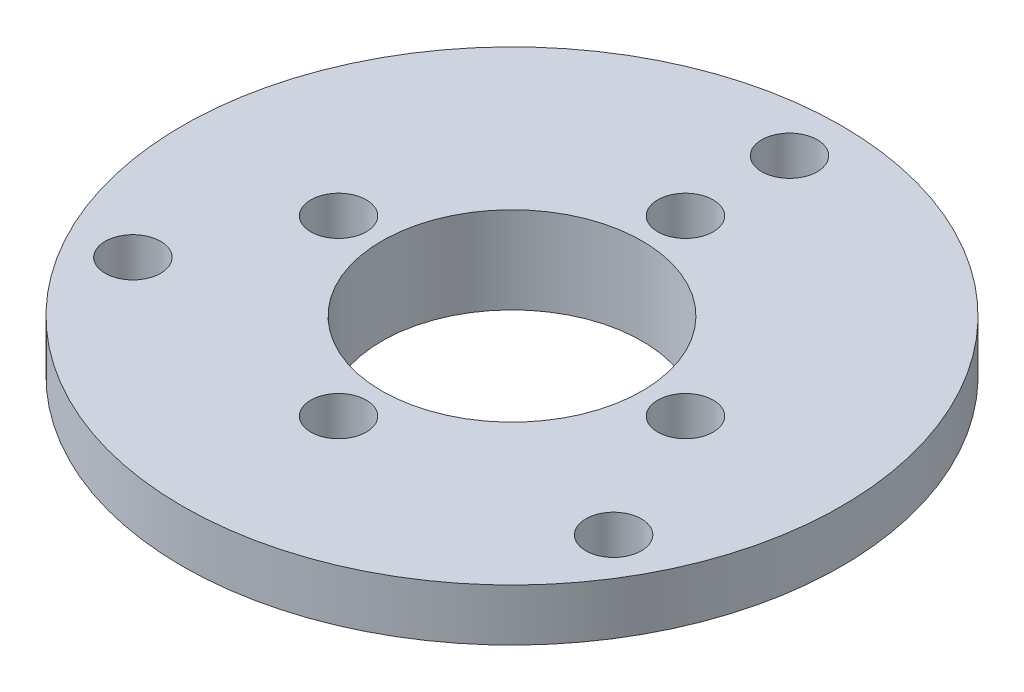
SolidWorks part; units mm, degrees
ref_plane "Face" through (0, 0, 0) normal (0, 0, 1) x (1, 0, 0)
ref_plane "Dessus" through (0, 0, 0) normal (0, 1, 0) x (1, 0, 0)
ref_plane "Droite" through (0, 0, 0) normal (1, 0, 0) x (0, 0, -1)
sketch "Esquisse1" plane through (0, 0, 0) normal (1, 0, 0) x (0, 0, -1)
  line L0 (0, 0) -> (0, -70.5308) construction
  line L1 (-7.5, -9.2262) -> (-7.5, -14.2262)
  line L4 (-7.5, -9.2262) -> (-19, -9.2262)
  line L5 (-19, -9.2262) -> (-19, -12.2262)
  line L6 (-7.5, -14.2262) -> (-13, -14.2262)
  line L7 (-13, -14.2262) -> (-13, -12.2262)
  line L8 (-13, -12.2262) -> (-19, -12.2262)
  dimension "D1" = 15
  dimension "D2" = 3
  dimension "D3" = 38
  dimension "D6" = 26
  dimension "D7" = 2
revolve "Révolution1" add sketch "Esquisse1" angle 360 about L0
chamfer "Chanfrein1" distance 0.2 angle 45 1 edges at (0, -14.2262, 13)
sketch "Esquisse4" plane through (0, -9.2262, 0) normal (0, 1, 0) x (1, 0, 0)
  line L3 (0, 16) -> (0, -10) construction
  line L4 (-10, 0) -> (10, 0) construction
  line L5 (0, 0) -> (13.8564, -8) construction
  line L6 (0, 0) -> (-13.8564, -8) construction
  circle A0 centre (0, 0) radius 16 construction
  circle A1 centre (0, 0) radius 10 construction
  dimension "D1" = 120
  dimension "D2" = 32
  dimension "D4" = 20
  dimension "D3" = 120
hole_wizard "Diamètre du perçage Ø3.2 (3.2)1" positions "Esquisse9" profile "Esquisse8" hole size "Ø3.2" standard "ISO"
sketch "Esquisse9" plane through (0, -14.2262, 0) normal (0, -1, 0) x (-1, 0, 0)
  line L3 (0, 16) -> (0, -10) construction
  circle A1 centre (0, 0) radius 10 construction
  point P18 (0, -10)
  point P22 (10, 0)
  point P24 (0, 10)
  point P26 (-10, 0)
  point P36 (-13.8564, -8)
  point P39 (0, 16)
  point P42 (13.8564, -8)
sketch "Esquisse8" plane through (0, -14.2262, 10) normal (1, 0, 0) x (0, 0, -1)
  line L0 (0, 0) -> (0, 5)
  line L1 (0, 5) -> (1.6, 5)
  line L2 (1.6, 5) -> (1.6, 0)
  line L5 (1.6, 0) -> (0, 0)
  line L11 (0, -6.35) -> (0, 107.95) construction
  dimension "Diamètre du perçage jusqu'au prochain" = 3.2
  dimension "Profondeur du perçage jusqu'au prochain" = 5
